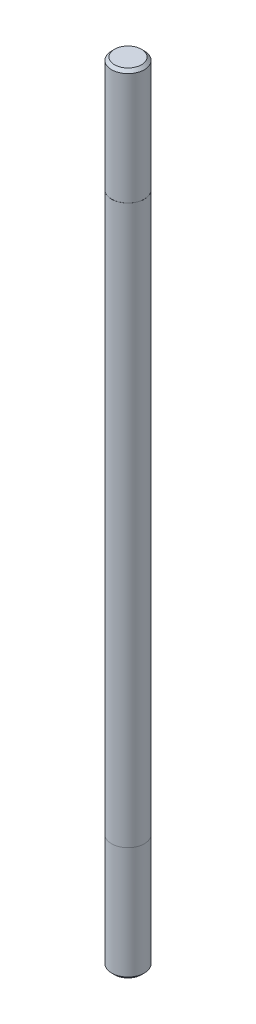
SolidWorks part; units mm, degrees
ref_plane "Front" through (0, 0, 0) normal (0, 0, 1) x (1, 0, 0)
ref_plane "Top" through (0, 0, 0) normal (0, 1, 0) x (1, 0, 0)
ref_plane "Right" through (0, 0, 0) normal (1, 0, 0) x (0, 0, -1)
sketch "Sketch1" plane through (0, 0, 0) normal (0, 1, 0) x (1, 0, 0)
  circle A0 centre (0, 0) radius 2
extrude "Extrude1" add sketch "Sketch1" along normal blind 68
sketch "Sketch2" plane through (0, 68, 0) normal (0, 1, 0) x (-1, 0, 0)
  circle A0 centre (0, 0) radius 1.99
extrude "Extrude2" add sketch "Sketch2" along normal blind 14
sketch "Sketch3" plane through (0, 0, 0) normal (0, -1, 0) x (1, 0, 0)
  circle A0 centre (0, 0) radius 1.99
extrude "Extrude3" add sketch "Sketch3" along normal blind 14
chamfer "Chamfer1" distance 0.35 angle 45 2 edges at (0, -14, -1.99) (0, 82, 1.99)
